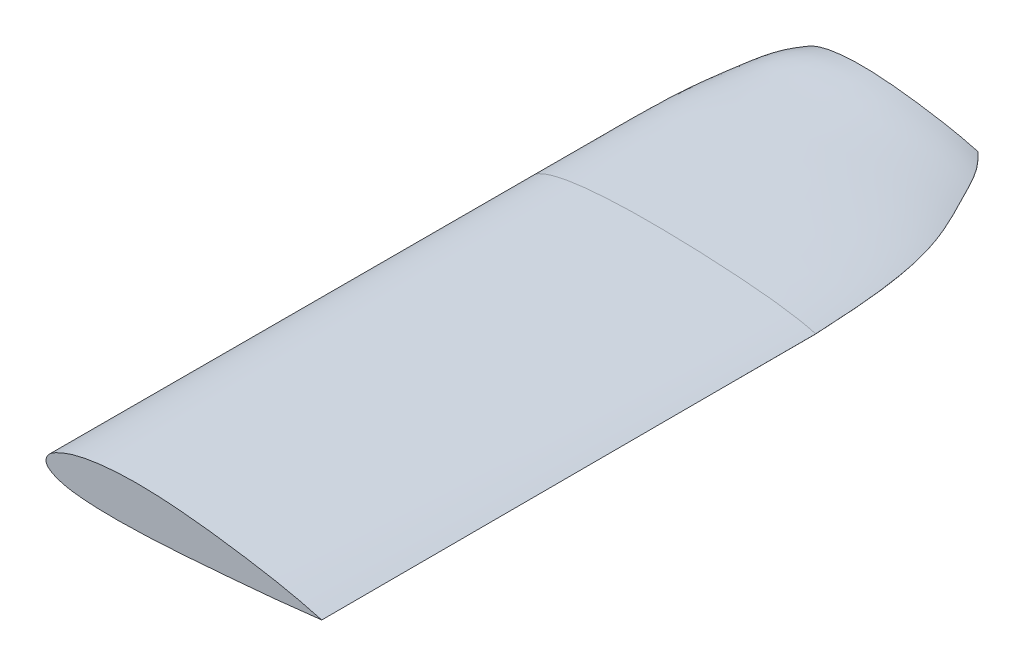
SolidWorks part; units mm, degrees
ref_plane "Front Plane" through (0, 0, 0) normal (0, 0, 1) x (1, 0, 0)
ref_plane "Top Plane" through (0, 0, 0) normal (0, 1, 0) x (1, 0, 0)
ref_plane "Right Plane" through (0, 0, 0) normal (1, 0, 0) x (0, 0, -1)
sketch "Sketch1" plane through (0, 0, 0) normal (0, 0, 1) x (1, 0, 0)
  line L0 (136.707, -0.044) -> (137, 0)
  spline S0 degree 3 poles (137, 0) (136.8047, 0.0547) (109.9926, 7.565) (61.2735, 16.4024) (-1.8853, 24.4056) (-48.2782, 26.4688) (-76.9293, 24.7314) (-95.6803, 22.0529) (-111.0828, 18.7646) (-124.736, 13.735) (-134.7807, 7.272) (-139.7412, -3.6501) (-123.4666, -11.2639) (-100.6214, -15.0743) (-63.7699, -16.1073) (-19.0594, -14.165) (18.59, -11.4583) (60.1256, -7.8909) (96.8384, -4.749) (126.74, -1.2202) (136.707, -0.044) knots 0 0 0 0 0.001082 0.148493 0.263252 0.340569 0.395749 0.416041 0.441515 0.47977 0.492552 0.505235 0.534441 0.562494 0.638712 0.724063 0.803562 0.83943 0.946478 1 1 1 1
sketch "Sketch2" plane through (0, 0, 0) normal (0, 1, 0) x (1, 0, 0)
  line L1 (23.78, 0) -> (196.7954, 0)
  line L2 (23.78, 0) -> (23.78, 728.6282)
  line L3 (23.78, 728.6282) -> (196.7954, 728.6282)
  line L4 (196.7954, 0) -> (196.7954, 728.6282)
  dimension "D1" = 728.6282
  dimension "D2" = 173.0154
  dimension "D3" = 23.78
ref_plane "rand" through (0, 0, -729) normal (0, 0, 1) x (1, 0, 0)
sketch "Sketch5" plane through (0, 0, -729) normal (0, 0, 1) x (1, 0, 0)
  line L2 (59.815, -0.0278) -> (60, 0)
sketch3d "3DSketch1"
  line L0 (-136.5357, 2.8155, 0) -> (-136.5357, 2.8155, -578.0824)
  line L1 (135.7035, -0.1624, 0) -> (135.7035, -0.1624, -491.6515) construction
  line L2 (0, 0, 0) -> (0, 0, -844.1423) construction
  point P2 (137, 0, 0)
  point P3 (136.707, -0.044, 0)
  point P4 (-134.8414, 2.8155, -629.2382)
  point P6 (-128.6407, 2.8155, -678.8439)
  point P8 (-118.5645, 2.8155, -716.8232)
  point P9 (129.1133, -0.1624, -572.0526)
  point P10 (-112.7069, 1.7777, -729)
  point P12 (114.6147, -0.1624, -632.6829)
  point P14 (88.7841, -0.1624, -687.6697)
  point P16 (70.4822, -0.1624, -717.8141)
  point P17 (60, 0, -729)
  point P18 (59.815, -0.0278, -729)
  point P19 (59.815, -0.0278, -729)
sketch3d "3D-Skizze1"
  line L0 (135.7035, -0.1624, 0) -> (135.7035, -0.1624, -491.6515) construction
  line L1 (135.7035, -0.1624, 0) -> (135.7035, -0.1624, -491.6515)
  point P1 (59.815, -0.0278, -729)
loft "Ausformung1" add profiles "Sketch1", "Sketch5"
